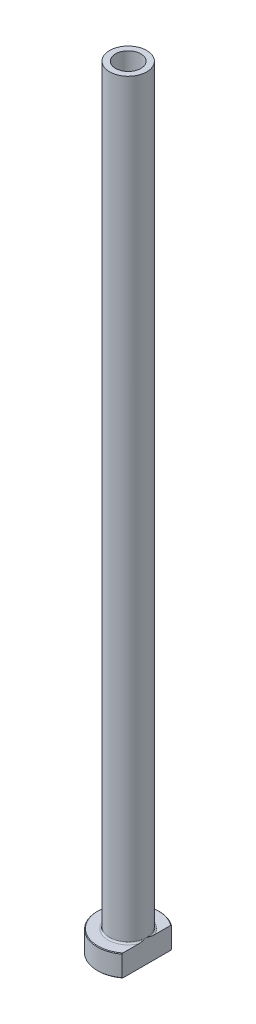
SolidWorks part; units mm, degrees
ref_plane "Front Plane" through (0, 0, 0) normal (0, 0, 1) x (1, 0, 0)
ref_plane "Top Plane" through (0, 0, 0) normal (0, 1, 0) x (1, 0, 0)
ref_plane "Right Plane" through (0, 0, 0) normal (1, 0, 0) x (0, 0, -1)
sketch "Sketch1" plane through (0, 0, 0) normal (0, 0, 1) x (1, 0, 0)
  line L0 (-4.1, 250) -> (-6, 250)
  line L1 (-6, 250) -> (-6, 7)
  line L2 (-6, 7) -> (-10, 7)
  line L3 (-10, 7) -> (-10, 0)
  line L4 (8.8, 0) -> (-8.8, 0) construction
  line L5 (-10, 0) -> (-4.35, 0)
  line L6 (-4.1, 205) -> (-4.1, 250)
  line L7 (0, 92.1877) -> (0, -15.5353) construction
  line L8 (0, -11) -> (0, 11) construction
  line L9 (-4.1, 205) -> (-4.35, 193)
  line L10 (-4.35, 193) -> (-4.35, 0)
  dimension "D1" = 0.25
  dimension "ID" = 8.2
  dimension "OD" = 12
  dimension "L" = 250
  dimension "H" = 20
  dimension "T" = 7
  dimension "N" = 45
  dimension "D2" = 12
  dimension "L-N" = 205
revolve "Revolve1" add sketch "Sketch1" angle 360 about L7
fillet "Fillet1" radius 0.5 1 edges at (0, 7, 6)
chamfer "Chamfer1" distance 0.2 angle 45 2 edges at (0, 7, 10) (0, 0, 10)
sketch "Sketch2" plane through (0, 0, 0) normal (0, -1, 0) x (1, 0, 0)
  line L0 (6, 8) -> (6, -8)
  circle A0 centre (0, 0) radius 10 construction
  arc A1 (6, 8) -> (6, -8) centre (0, 0) cw
  circle A2 centre (0, 0) radius 6 construction
extrude "Cut-Extrude1" cut sketch "Sketch2" against normal through all
chamfer "Chamfer2" distance 0.5 angle 45 1 edges at (0, 0, 4.35)
